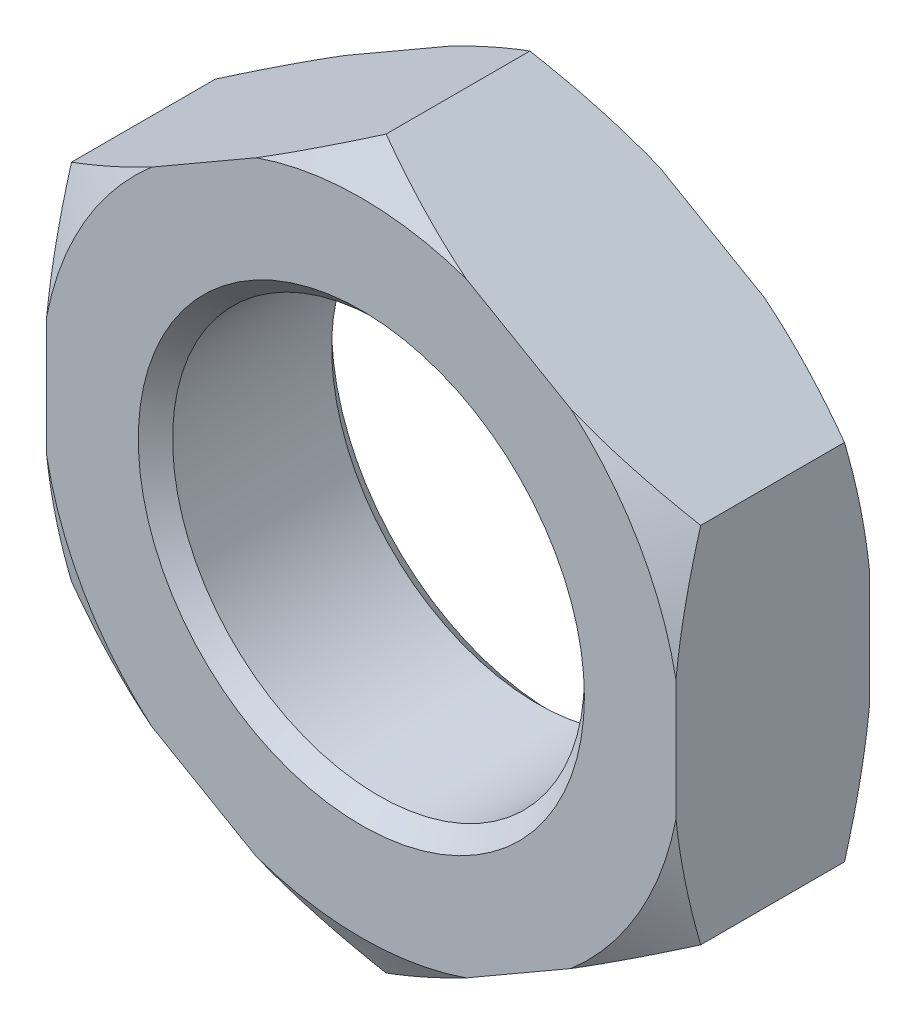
SolidWorks part; units mm, degrees
ref_plane "Front Plane" through (0, 0, 0) normal (0, 0, 1) x (1, 0, 0)
ref_plane "Top Plane" through (0, 0, 0) normal (0, 1, 0) x (1, 0, 0)
ref_plane "Right Plane" through (0, 0, 0) normal (1, 0, 0) x (0, 0, -1)
sketch "Sketch3" plane through (0, 0, 0) normal (0, 0, 1) x (1, 0, 0)
  line L1 (0, 31.7543) -> (-27.5, 15.8771)
  line L2 (-27.5, 15.8771) -> (-27.5, -15.8771)
  line L3 (-27.5, -15.8771) -> (0, -31.7543)
  line L4 (0, -31.7543) -> (27.5, -15.8771)
  line L5 (27.5, -15.8771) -> (27.5, 15.8771)
  line L6 (27.5, 15.8771) -> (0, 31.7543)
  circle A0 centre (0, 0) radius 27.5 construction
  dimension "D1" = 55
extrude "Boss-Extrude1" add sketch "Sketch3" along normal mid plane 16.9
sketch "Sketch4" plane through (0, 0, 0) normal (1, 0, 0) x (0, 0, -1)
  line L0 (-5.4578, 0) -> (6.1545, 0) construction
sketch "Sketch5" plane through (0, 0, 0) normal (1, 0, 0) x (0, 0, -1)
  line L0 (-8.45, 31.7543) -> (-8.45, 28.0043)
  line L1 (-8.45, 15.8771) -> (-8.45, 31.7543) construction
  line L2 (-8.45, 28.0043) -> (-6.2849, 31.7543)
  line L3 (-8.45, 31.7543) -> (8.45, 31.7543) construction
  line L4 (-6.2849, 31.7543) -> (-8.45, 31.7543)
  dimension "D1" = 3.75
  dimension "D2" = 30
revolve "Cut-Revolve1" cut sketch "Sketch5" angle 360 about L0
mirror "Mirror1" about plane through (0, 0, 0) normal (0, 0, 1) of "Cut-Revolve1"
sketch "Sketch6" plane through (0, 0, 8.45) normal (0, 0, 1) x (1, 0, 0)
  circle A0 centre (0, 0) radius 18
  dimension "D1" = 36
extrude "Cut-Extrude1" cut sketch "Sketch6" against normal blind 16.9
chamfer "Chamfer1" distance 1.5 angle 45 2 edges at (18, 0, -8.45) (18, 0, 8.45)
